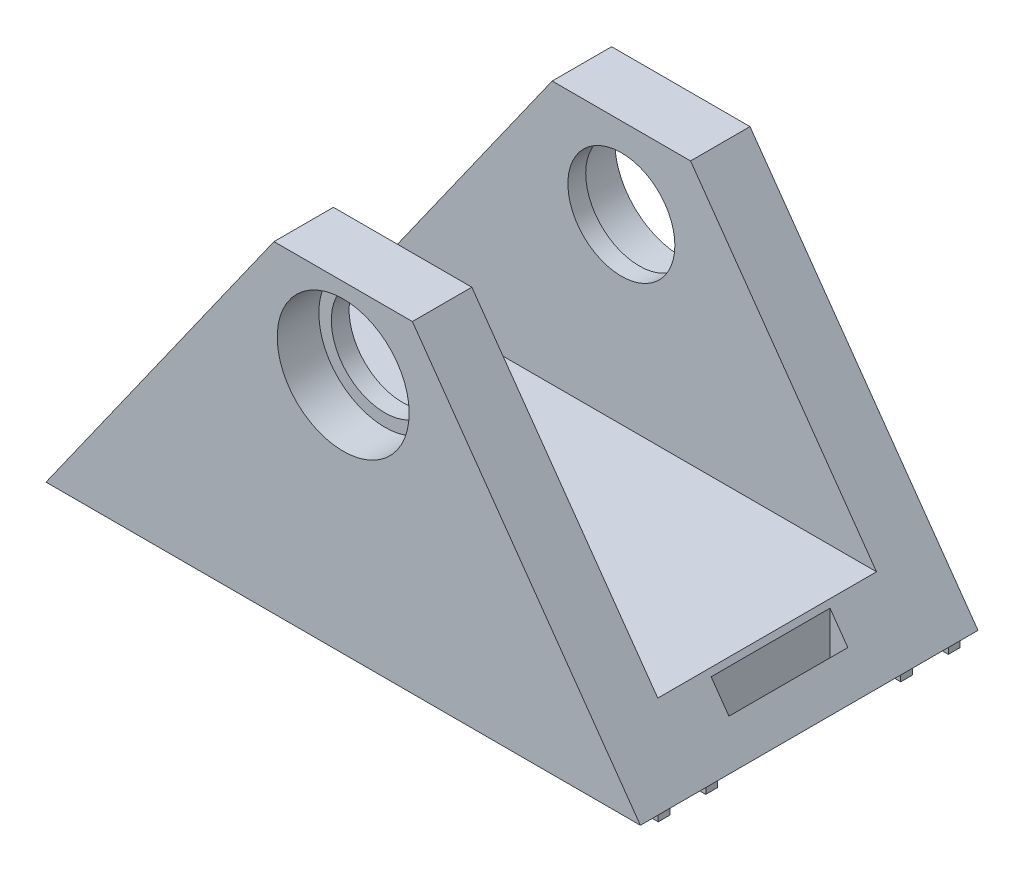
SolidWorks part; units mm, degrees
ref_plane "Спереди" through (0, 0, 0) normal (0, 0, 1) x (1, 0, 0)
ref_plane "Сверху" through (0, 0, 0) normal (0, 1, 0) x (1, 0, 0)
ref_plane "Справа" through (0, 0, 0) normal (1, 0, 0) x (0, 0, -1)
sketch "Эскиз1" plane through (0, 0, 0) normal (0, 1, 0) x (1, 0, 0)
  line L1 (-50, -14.2) -> (50, -14.2)
  line L2 (-50, -14.2) -> (-50, 14.2)
  line L3 (-50, 14.2) -> (50, 14.2)
  line L4 (50, -14.2) -> (50, 14.2)
  line L5 (-50, -14.2) -> (50, 14.2) construction
  line L6 (-50, 14.2) -> (50, -14.2) construction
  point P0 (0, 0)
  dimension "D1" = 100
  dimension "D2" = 28.4
extrude "Бобышка-Вытянуть1" add sketch "Эскиз1" along normal blind 10
sketch "Эскиз2" plane through (0, 10, 0) normal (0, 1, 0) x (1, 0, 0)
  line L0 (-50, -4.2) -> (50, -4.2)
  line L1 (-50, 14.2) -> (-50, -14.2) construction
  line L2 (50, -14.2) -> (50, 14.2) construction
  line L7 (50, -14.2) -> (50, 14.2)
  line L8 (50, 14.2) -> (-50, 14.2)
  line L9 (-50, 14.2) -> (-50, -14.2)
  line L10 (-50, -14.2) -> (50, -14.2)
  line L11 (50, -14.2) -> (50, -4.2)
  line L13 (-50, -4.2) -> (-50, -14.2)
  line L14 (-50, -14.2) -> (50, -14.2)
  dimension "D1" = 10
  dimension "D2" = 0
extrude "Бобышка-Вытянуть2" add sketch "Эскиз2" along normal blind 45.6
fillet "Скругление2" radius 50 2 edges at (50, 55.6, 9.2) (-50, 55.6, 9.2)
sketch "Эскиз3" plane through (0, 0, 14.2) normal (0, 0, 1) x (1, 0, 0)
  line L0 (0, 55.6) -> (0, 0) construction
  line L1 (-50, 0) -> (50, 0) construction
  circle A0 centre (0, 40.6) radius 11.1
  dimension "D1" = 15
  dimension "D2" = 22.2
extrude "Вырез-Вытянуть1" cut sketch "Эскиз3" against normal blind 7
mirror "Зеркальное отражение2" about plane through (-50, 10, -14.2) normal (0, 0, 1) of "Бобышка-Вытянуть2", "Бобышка-Вытянуть1", "Скругление2", "Вырез-Вытянуть1"
sketch "Эскиз8" plane through (0, 0, 7.2) normal (0, 0, 1) x (1, 0, 0)
  circle A0 centre (0, 40.6) radius 9
extrude "Вырез-Вытянуть2" cut sketch "Эскиз8" against normal through all
sketch "Sketch1" plane through (0, 0, 0) normal (0, -1, 0) x (1, 0, 0)
  line L0 (-50, -22.6) -> (50, -22.6) construction
  line L1 (-50, -42.6) -> (-50, 14.2) construction
  line L2 (50, 14.2) -> (50, -42.6) construction
  line L3 (-50, 11.2) -> (-50, 9.2)
  line L4 (-50, 9.2) -> (50, 9.2)
  line L5 (50, 9.2) -> (50, 11.2)
  line L6 (50, 11.2) -> (-50, 11.2)
  line L7 (-50, 3.2) -> (-50, 1.2)
  line L8 (-50, 1.2) -> (50, 1.2)
  line L9 (50, 1.2) -> (50, 3.2)
  line L10 (50, 3.2) -> (-50, 3.2)
  line L11 (-50, -29.6) -> (50, -29.6)
  line L12 (50, -29.6) -> (50, -31.6)
  line L13 (50, -31.6) -> (-50, -31.6)
  line L14 (-50, -31.6) -> (-50, -29.6)
  line L15 (-50, -37.6) -> (50, -37.6)
  line L16 (50, -37.6) -> (50, -39.6)
  line L17 (50, -39.6) -> (-50, -39.6)
  line L18 (-50, -39.6) -> (-50, -37.6)
  line L19 (0, 11.2) -> (0, 3.2) construction
  line L20 (0, -29.6) -> (0, -37.6) construction
  line L21 (-50, 14.2) -> (50, 14.2) construction
  line L22 (-50, -42.6) -> (50, -42.6) construction
  text T0 "SIMCHAIR MKIII" font "Arial" height 18
  point P31 (0, -39.6)
  dimension "D1" = 8
  dimension "D2" = 2
  dimension "D3" = 3
  dimension "D4" = 7
  dimension "D5" = 3
  dimension "D6" = 30.8
sketch "Sketch2" plane through (0, 0, 0) normal (0, -1, 0) x (1, 0, 0)
  line L0 (-45, 14.2) -> (-45, -42.6) construction
  line L1 (-50, 14.2) -> (50, 14.2) construction
  line L2 (-50, -42.6) -> (50, -42.6) construction
  line L3 (45, 14.2) -> (45, -42.6) construction
  line L5 (-43.5, -24.2) -> (-46.5, -24.2)
  line L6 (-43.5, -24.2) -> (-43.5, -4.2)
  line L7 (-43.5, -4.2) -> (-46.5, -4.2)
  line L8 (-46.5, -24.2) -> (-46.5, -4.2)
  line L9 (-43.5, -24.2) -> (-46.5, -4.2) construction
  line L10 (-43.5, -4.2) -> (-46.5, -24.2) construction
  line L11 (46.5, -24.2) -> (43.5, -24.2)
  line L12 (46.5, -24.2) -> (46.5, -4.2)
  line L13 (46.5, -4.2) -> (43.5, -4.2)
  line L14 (43.5, -24.2) -> (43.5, -4.2)
  line L15 (46.5, -24.2) -> (43.5, -4.2) construction
  line L16 (46.5, -4.2) -> (43.5, -24.2) construction
  point P8 (-45, -14.2)
  point P14 (45, -14.2)
  dimension "D1" = 90
  dimension "D2" = 45
  dimension "D3" = 20
  dimension "D4" = 3
extrude "Cut-Extrude1" cut sketch "Sketch2" against normal through all
sketch "Sketch3" plane through (0, 0, -42.6) normal (0, 0, -1) x (-1, 0, 0)
  line L0 (-50, 0) -> (-11.6418, 54.2258)
  line L1 (50, 0) -> (11.6418, 54.2258)
  line L2 (-50, 0) -> (50, 0)
  arc A0 (0, 55.6) -> (-50, 5.6) centre (0, 5.6) ccw construction
  arc A1 (50, 5.6) -> (0, 55.6) centre (0, 5.6) ccw construction
  arc A2 (-11.6418, 54.2258) -> (11.6418, 54.2258) centre (0, 5.6) cw
extrude "Cut-Extrude3" cut sketch "Sketch3" against normal through all flip side to cut
extrude "Boss-Extrude1" add sketch "Sketch1" along normal blind 1
sketch "Sketch4" plane through (0, 0, 14.2) normal (0, 0, 1) x (1, 0, 0)
  line L0 (11.6418, 54.2258) -> (-11.6418, 54.2258)
  arc A0 (-11.6418, 54.2258) -> (11.6418, 54.2258) centre (0, 5.6) cw
extrude "Cut-Extrude4" cut sketch "Sketch4" against normal through all
